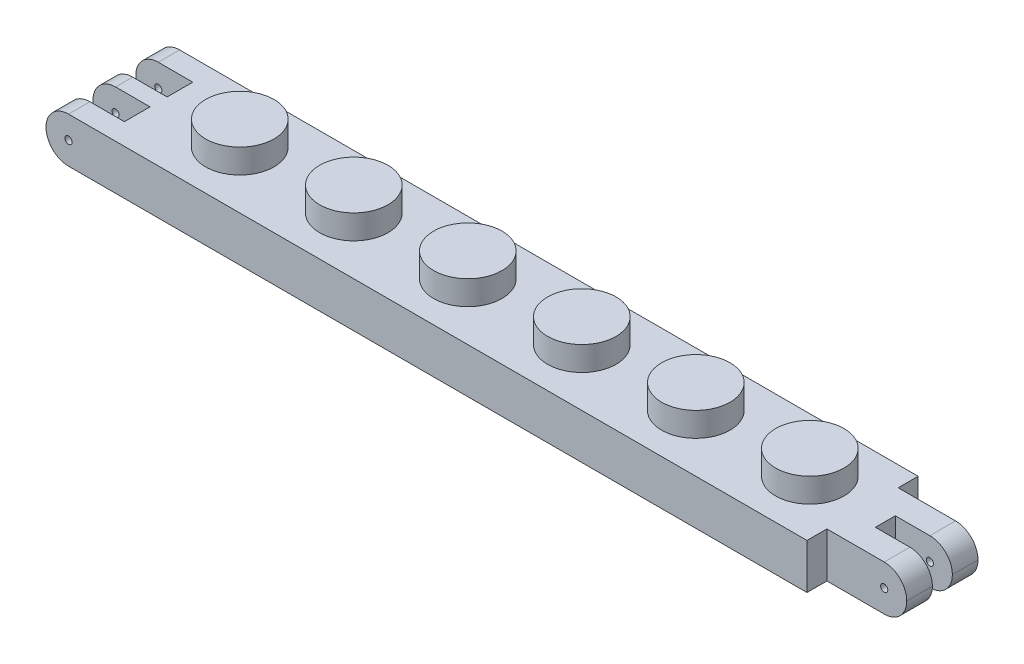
SolidWorks part; units mm, degrees
ref_plane "Front Plane" through (0, 0, 0) normal (0, 0, 1) x (1, 0, 0)
ref_plane "Top Plane" through (0, 0, 0) normal (0, 1, 0) x (1, 0, 0)
ref_plane "Right Plane" through (0, 0, 0) normal (1, 0, 0) x (0, 0, -1)
sketch "Sketch1" plane through (0, 0, 0) normal (0, 1, 0) x (1, 0, 0)
  line L1 (0, 0) -> (47.8, 0)
  line L2 (0, 0) -> (0, 7.8)
  line L3 (0, 7.8) -> (47.8, 7.8)
  line L4 (47.8, 0) -> (47.8, 7.8)
  dimension "D1" = 47.8
  dimension "D2" = 7.8
extrude "Extrude1" add sketch "Sketch1" along normal blind 3.166
sketch "Sketch2" plane through (0, 3.166, 0) normal (0, 1, 0) x (1, 0, 0)
  circle A0 centre (4, 4) radius 2.4
  point P6 (9.3567, 6.1688)
  dimension "D1" = 4.8
extrude "Extrude2" add sketch "Sketch2" along normal blind 1.7
sketch "Sketch3" plane through (0, 0, 0) normal (0, -1, 0) x (1, 0, 0)
  line L0 (47.8, 0) -> (47.8, -7.8) construction
  line L1 (41.55, -1.55) -> (46.35, -1.55)
  line L2 (41.55, -1.55) -> (41.55, -6.35)
  line L3 (41.55, -6.35) -> (46.35, -6.35)
  line L4 (46.35, -1.55) -> (46.35, -6.35)
  line L5 (47.8, -7.8) -> (0, -7.8) construction
  dimension "D1" = 4.8
  dimension "D2" = 1.45
  dimension "D3" = 1.45
extrude "Extrude3" cut sketch "Sketch3" against normal blind 1.8
sketch "Sketch4" plane through (0, 3.166, 0) normal (0, 1, 0) x (1, 0, 0)
  line L0 (0, 3.9) -> (49.6177, 3.9) construction
  line L1 (0, 7.8) -> (0, 0) construction
pattern_linear "LPattern1" count 6 spacing 8 along (1, 0, 0) of "Extrude2"
pattern_linear "LPattern2" count 6 spacing 8 along (-1, 0, 0) of "Extrude3"
sketch "Sketch5" plane through (47.8, 0, 0) normal (1, 0, 0) x (0, 0, -1)
  line L0 (3.9, 3.166) -> (3.9, -0.7333) construction
  line L1 (0, 3.166) -> (7.8, 3.166) construction
  line L2 (0, 0) -> (7.8, 0) construction
  line L3 (1.4, 3.166) -> (6.4, 3.166)
  line L4 (1.4, 3.166) -> (1.4, 0)
  line L5 (1.4, 0) -> (6.4, 0)
  line L6 (6.4, 3.166) -> (6.4, 0)
  dimension "D1" = 5
  dimension "D2" = 2.5
extrude "Boss-Extrude1" add sketch "Sketch5" along normal blind 5.6
sketch "Sketch6" plane through (53.4, 0, 0) normal (1, 0, 0) x (0, 0, -1)
  line L0 (6.4, 3.166) -> (1.4, 3.166) construction
  line L1 (3.2, 3.166) -> (4.6, 3.166)
  line L2 (3.2, 3.166) -> (3.2, 0)
  line L3 (3.2, 0) -> (4.6, 0)
  line L4 (4.6, 3.166) -> (4.6, 0)
  line L5 (1.4, 0) -> (6.4, 0) construction
  line L6 (1.4, 3.166) -> (1.4, 0) construction
  line L7 (6.4, 0) -> (6.4, 3.166) construction
  dimension "D1" = 1.8
  dimension "D2" = 1.8
extrude "Cut-Extrude1" cut sketch "Sketch6" against normal blind 4
fillet "Fillet1" radius 1.58 4 edges at (53.4, 0, -5.5) (53.4, 3.166, -5.5) (53.4, 0, -2.3) (53.4, 3.166, -2.3)
sketch "Sketch7" plane through (0, 0, -1.4) normal (0, 0, 1) x (1, 0, 0)
  circle A0 centre (51.82, 1.58) radius 0.25
  dimension "D1" = 0.5
extrude "Cut-Extrude2" cut sketch "Sketch7" against normal through all
sketch "Sketch8" plane through (0, 0, 0) normal (-1, 0, 0) x (0, 0, 1)
  line L1 (-7.8, 3.166) -> (0, 3.166)
  line L2 (-7.8, 3.166) -> (-7.8, 0)
  line L3 (-7.8, 0) -> (0, 0)
  line L4 (0, 3.166) -> (0, 0)
extrude "Boss-Extrude2" add sketch "Sketch8" along normal blind 5.6
sketch "Sketch9" plane through (0, 3.166, 0) normal (0, 1, 0) x (1, 0, 0)
  line L0 (-5.6, 0) -> (-5.6, 7.8) construction
  line L1 (-5.6, 6.3) -> (-1.6, 6.3)
  line L2 (-5.6, 6.3) -> (-5.6, 4.5)
  line L3 (-5.6, 4.5) -> (-1.6, 4.5)
  line L4 (-1.6, 6.3) -> (-1.6, 4.5)
  line L5 (47.8, 7.8) -> (-5.6, 7.8) construction
  line L6 (-5.6, 3.3) -> (-1.6, 3.3)
  line L7 (-5.6, 3.3) -> (-5.6, 1.5)
  line L8 (-5.6, 1.5) -> (-1.6, 1.5)
  line L9 (-1.6, 3.3) -> (-1.6, 1.5)
  line L10 (-5.6, 0) -> (47.8, 0) construction
  dimension "D1" = 1.8
  dimension "D2" = 1.8
  dimension "D3" = 1.5
  dimension "D4" = 1.5
  dimension "D5" = 4
  dimension "D6" = 4
extrude "Cut-Extrude3" cut sketch "Sketch9" against normal through all
fillet "Fillet2" radius 1.58 6 edges at (-5.6, 0, -0.75) (-5.6, 3.166, -0.75) (-5.6, 3.166, -3.9) (-5.6, 0, -3.9) (-5.6, 0, -7.05) (-5.6, 3.166, -7.05)
sketch "Sketch10" plane through (0, 0, -7.8) normal (0, 0, -1) x (-1, 0, 0)
  circle A0 centre (4.02, 1.58) radius 0.25
  dimension "D1" = 0.5
extrude "Cut-Extrude4" cut sketch "Sketch10" against normal through all
